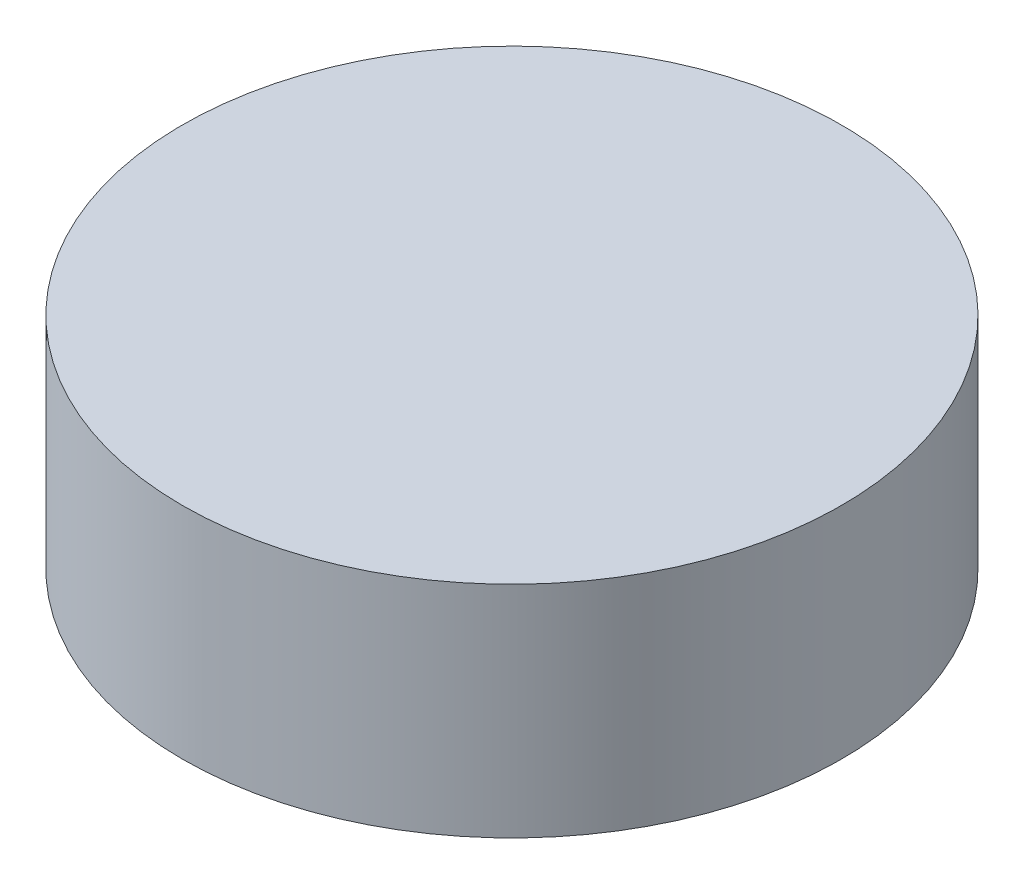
SolidWorks part; units mm, degrees
ref_plane "Piano frontale" through (0, 0, 0) normal (0, 0, 1) x (1, 0, 0)
ref_plane "Piano superiore" through (0, 0, 0) normal (0, 1, 0) x (1, 0, 0)
ref_plane "Piano destro" through (0, 0, 0) normal (1, 0, 0) x (0, 0, -1)
sketch "Schizzo1" plane through (0, 0, 0) normal (0, 1, 0) x (1, 0, 0)
  circle A0 centre (0, 0) radius 15
  dimension "D1" = 30
extrude "Estrusione1" add sketch "Schizzo1" against normal blind 10
